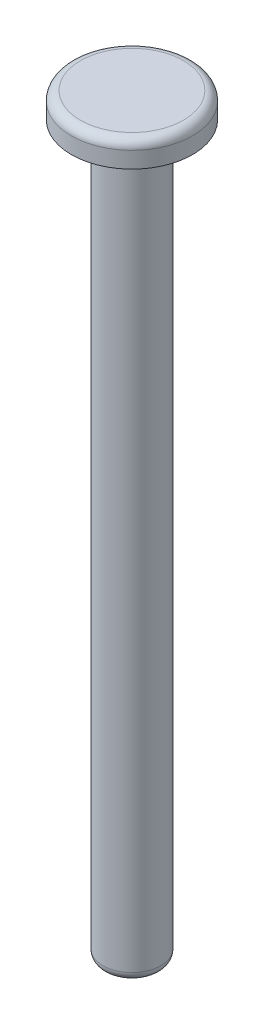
SolidWorks part; units mm, degrees
ref_plane "Face" through (0, 0, 0) normal (0, 0, 1) x (1, 0, 0)
ref_plane "Dessus" through (0, 0, 0) normal (0, 1, 0) x (1, 0, 0)
ref_plane "Droite" through (0, 0, 0) normal (1, 0, 0) x (0, 0, -1)
sketch "Esquisse1" plane through (0, 0, 0) normal (0, 1, 0) x (1, 0, 0)
  circle A0 centre (0, 0) radius 1.6
extrude "Extrusion1" add sketch "Esquisse1" along normal blind 40.2
sketch "Esquisse2" plane through (0, 40.2, 0) normal (0, 1, 0) x (-1, 0, 0)
  circle A0 centre (0, 0) radius 3.35
extrude "Extrusion2" add sketch "Esquisse2" along normal blind 1.4
fillet "Congé1" radius 0.5 2 edges at (0, 41.6, 3.35) (0, 0, 1.6)
